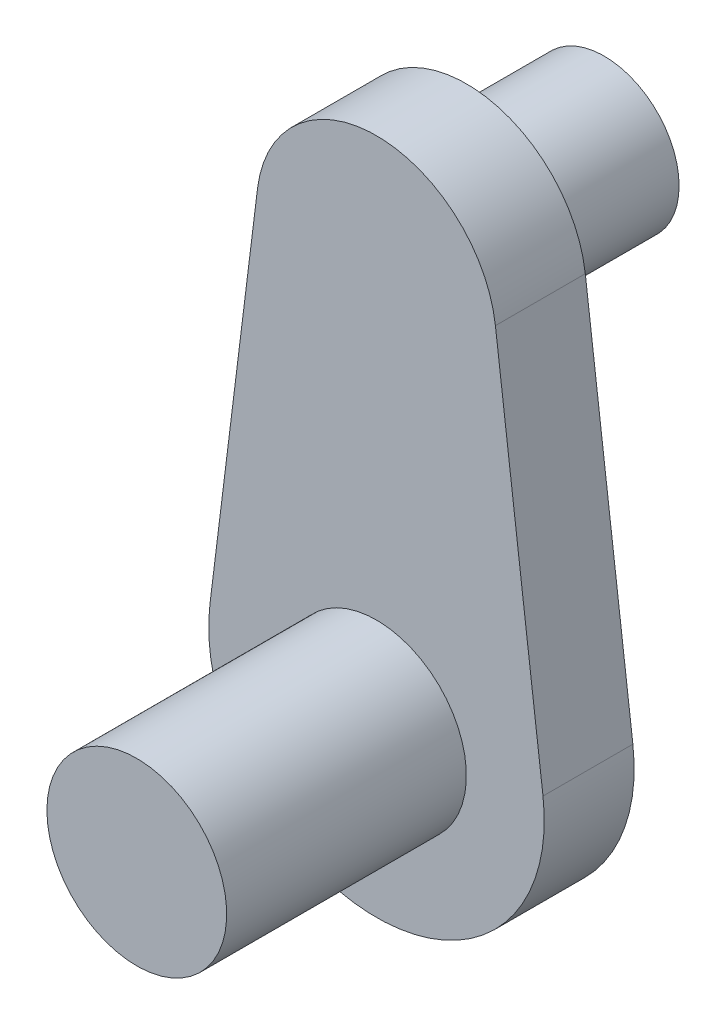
SolidWorks part; units mm, degrees
ref_plane "Płaszczyzna przednia" through (0, 0, 0) normal (0, 0, 1) x (1, 0, 0)
ref_plane "Płaszczyzna górna" through (0, 0, 0) normal (0, 1, 0) x (1, 0, 0)
ref_plane "Płaszczyzna prawa" through (0, 0, 0) normal (1, 0, 0) x (0, 0, -1)
other "Przekształcone1"
